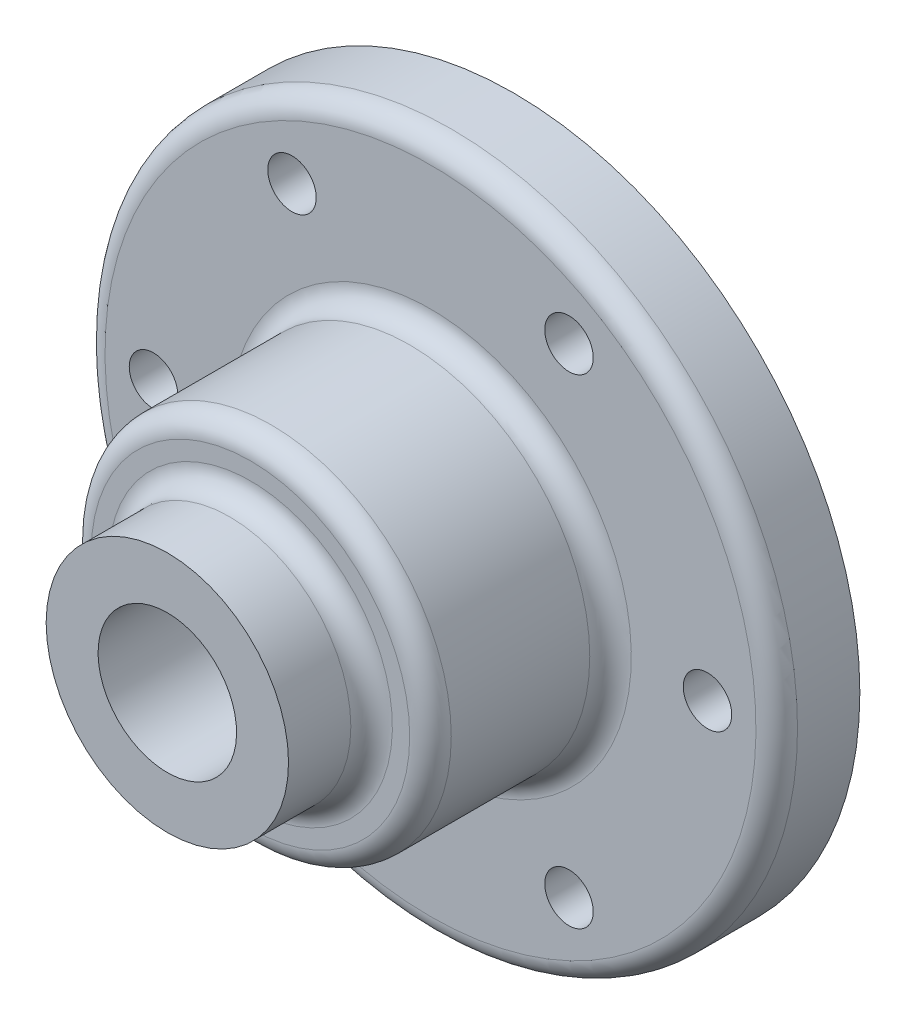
SolidWorks part; units mm, degrees
ref_plane "Front Plane" through (0, 0, 0) normal (0, 0, 1) x (1, 0, 0)
ref_plane "Top Plane" through (0, 0, 0) normal (0, 1, 0) x (1, 0, 0)
ref_plane "Right Plane" through (0, 0, 0) normal (1, 0, 0) x (0, 0, -1)
sketch "Sketch1" plane through (0, 0, 0) normal (1, 0, 0) x (0, 0, -1)
  line L0 (0, 0) -> (-50, 0) construction
  line L1 (-50, 17.5) -> (-50, 10)
  line L2 (-50, 17.5) -> (-38, 17.5)
  line L3 (-38, 17.5) -> (-38, 26)
  line L4 (-38, 26) -> (-12, 26)
  line L5 (-12, 26) -> (-12, 50)
  line L6 (-12, 50) -> (0, 50)
  line L7 (0, 50) -> (0, 20)
  line L8 (0, 20) -> (-10, 20)
  line L9 (-10, 20) -> (-10, 10)
  line L10 (-10, 10) -> (-50, 10)
  dimension "D1" = 100
  dimension "D2" = 40
  dimension "D3" = 52
  dimension "D4" = 35
  dimension "D5" = 20
  dimension "D6" = 50
  dimension "D7" = 10
  dimension "D8" = 12
  dimension "D9" = 12
revolve "Revolve1" add sketch "Sketch1" angle 360 about L0
hole_wizard "Ø7.0 (7) Diameter Hole1" positions "Sketch2" profile "Sketch3" hole size "Ø7.0" standard "ANSI Metric"
sketch "Sketch2" plane through (0, 0, 12) normal (0, 0, 1) x (1, 0, 0)
  circle A0 centre (0, 0) radius 40 construction
  point P5 (40, 0)
  dimension "D1" = 80
sketch "Sketch3" plane through (40, 0, 12) normal (1, 0, 0) x (0, -1, 0)
  line L0 (0, 0) -> (0, 12)
  line L1 (0, 12) -> (3.5, 12)
  line L2 (3.5, 12) -> (3.5, 0)
  line L5 (3.5, 0) -> (0, 0)
  line L11 (0, -6.35) -> (0, 107.95) construction
  dimension "Thru Hole Dia." = 7
  dimension "Thru Hole Depth" = 12
pattern_circular "CirPattern1" count 6 over 360 about axis through (0, 0, 0) along (0, 0, 1) of "Ø7.0 (7) Diameter Hole1"
fillet "Fillet1" radius 3 4 edges at (0, 17.5, 38) (0, 26, 38) (0, 26, 12) (0, 50, 12)
sketch "Groove Sketch" plane through (0, 0, 0) normal (0, 1, 0) x (0, 0, 1)
  line L0 (2.075, 27.25) -> (0, 27.25)
  line L1 (0, 27.25) -> (0, 30.8)
  line L2 (0, 30.8) -> (2.075, 30.8)
  line L3 (2.675, 30.2) -> (2.675, 27.85)
  line L4 (-50, 0) -> (50, 0) construction
  line L5 (0, -50) -> (0, 50) construction
  arc A0 (2.075, 30.8) -> (2.675, 30.2) centre (2.075, 30.2) cw
  arc A1 (2.675, 27.85) -> (2.075, 27.25) centre (2.075, 27.85) cw
  point P10 (0, 0)
  dimension "D1" = 2.675
  dimension "D2" = 0.6
  dimension "ID" = 54.5
  dimension "OD" = 61.6
revolve "O-Ring Groove" cut sketch "Groove Sketch" angle 360 about L4
